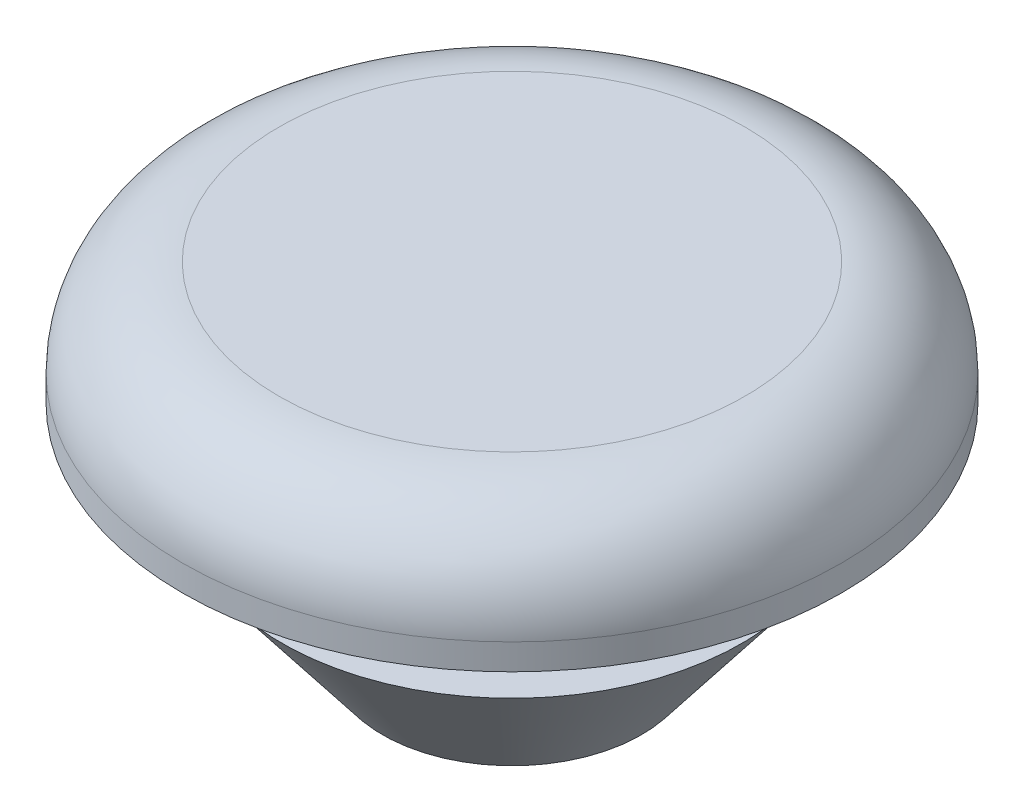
SolidWorks part; units mm, degrees
ref_plane "Front Plane" through (0, 0, 0) normal (0, 0, 1) x (1, 0, 0)
ref_plane "Top Plane" through (0, 0, 0) normal (0, 1, 0) x (1, 0, 0)
ref_plane "Right Plane" through (0, 0, 0) normal (1, 0, 0) x (0, 0, -1)
sketch "Sketch1" plane through (0, 0, 0) normal (1, 0, 0) x (0, 0, -1)
  line L0 (0, 0) -> (0, 29.8408) construction
  line L1 (0, 0) -> (3.175, 0)
  line L2 (3.175, 0) -> (5.6388, 3.175)
  line L3 (5.6388, 3.175) -> (3.7592, 3.175)
  line L4 (3.7592, 3.175) -> (3.7592, 5.461)
  line L5 (3.7592, 5.461) -> (8.0772, 5.461)
  line L6 (0, 8.4582) -> (5.715, 8.4582)
  line L7 (8.0772, 6.096) -> (8.0772, 5.461)
  line L8 (0, 0) -> (0, 8.4582)
  arc A0 (5.715, 8.4582) -> (8.0772, 6.096) centre (5.715, 6.096) cw
  dimension "D6" = 0.635
  dimension "D1" = 7.5184
  dimension "D2" = 3.175
  dimension "D3" = 6.35
  dimension "D4" = 11.2776
  dimension "D5" = 2.286
  dimension "D7" = 2.9972
  dimension "D8" = 11.43
  dimension "D9" = 16.1544
revolve "Revolve1" add sketch "Sketch1" angle 360 about L0
